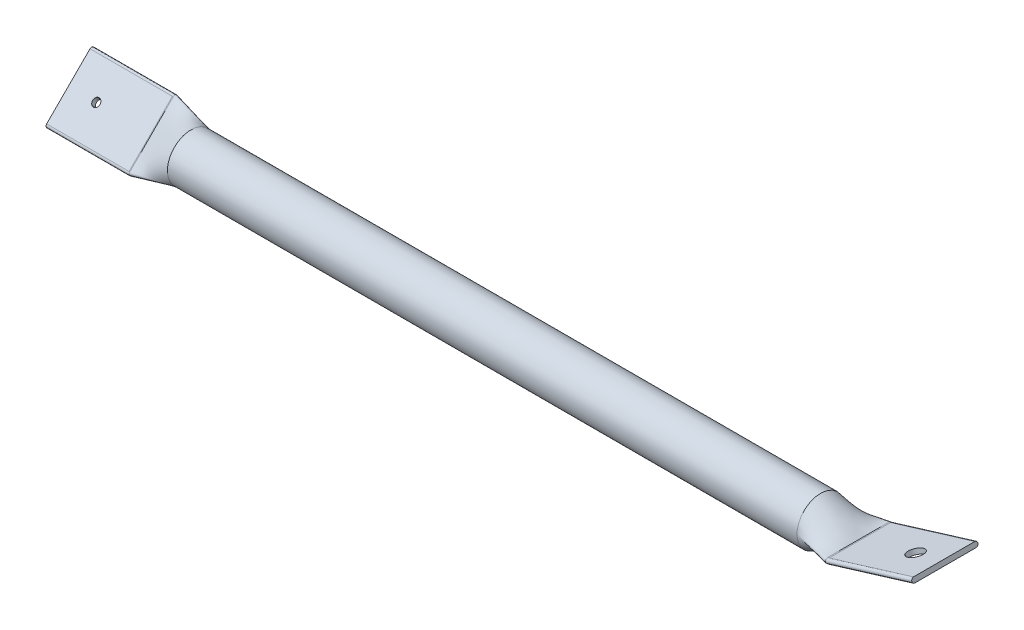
SolidWorks part; units mm, degrees
ref_plane "Front Plane" through (0, 0, 0) normal (0, 0, 1) x (1, 0, 0)
ref_plane "Top Plane" through (0, 0, 0) normal (0, 1, 0) x (1, 0, 0)
ref_plane "Right Plane" through (0, 0, 0) normal (1, 0, 0) x (0, 0, -1)
sketch "Sketch1" plane through (0, 0, 0) normal (1, 0, 0) x (0, 0, -1)
  circle A1 centre (0, 0) radius 23.9141
  dimension "D1" = 47.8282
extrude "Boss-Extrude1" add sketch "Sketch1" along normal mid plane 635
sketch "Sketch2" plane through (0, 0, 0) normal (0, 1, 0) x (1, 0, 0)
  line L0 (0, -33.3375) -> (0, 33.3375) construction
  line L1 (-355.6, 33.3375) -> (355.6, 33.3375)
  line L2 (-355.6, 33.3375) -> (-355.6, -33.3375)
  line L3 (-355.6, -33.3375) -> (355.6, -33.3375)
  line L4 (355.6, 33.3375) -> (355.6, -33.3375)
  line L5 (317.5, -23.9141) -> (317.5, 23.9141) construction
  dimension "D1" = 38.1
  dimension "D2" = 66.675
ref_plane "Plane1" through (355.6, 0, 0) normal (1, 0, 0) x (0, 0, -1)
sketch "Sketch3" plane through (355.6, 0, 0) normal (1, 0, 0) x (0, 0, -1)
  line L0 (-30.9245, 2.413) -> (30.9245, 2.413)
  line L1 (-30.9245, -2.413) -> (30.9245, -2.413)
  line L2 (0, 2.413) -> (0, -2.413) construction
  arc A0 (30.9245, 2.413) -> (30.9245, -2.413) centre (30.9245, 0) cw
  arc A1 (-30.9245, 2.413) -> (-30.9245, -2.413) centre (-30.9245, 0) ccw
  dimension "D1" = 4.826
sketch "Sketch4" plane through (317.5, 0, 0) normal (1, 0, 0) x (0, 0, -1)
  circle A1 centre (0, 0) radius 23.9141
  circle A2 centre (0, 0) radius 23.9141
  dimension "D1" = 0
loft "Loft1" add profiles "Sketch4", "Sketch3"
sketch "Sketch5" plane through (0, 0, 0) normal (0, 0, 1) x (1, 0, 0)
  line L0 (355.6, 2.413) -> (355.6, -2.413)
  line L1 (355.6, 2.413) -> (355.6, 7.239) construction
  line L2 (358.422, -1.9913) -> (355.6, 7.239) construction
  line L3 (357.011, 2.6239) -> (442.0265, 28.6157)
  line L4 (358.422, -1.9913) -> (443.4375, 24.0006)
  line L5 (443.4375, 24.0006) -> (442.0265, 28.6157)
  arc A0 (355.6, 2.413) -> (357.011, 2.6239) centre (355.6, 7.239) ccw
  arc A1 (355.6, -2.413) -> (358.422, -1.9913) centre (355.6, 7.239) ccw
  dimension "D2" = 4.826
  dimension "D1" = 17
  dimension "D3" = 88.9
extrude "Boss-Extrude2" add sketch "Sketch5" along normal up to vertex and the other way up to vertex
sketch "Sketch6" plane through (29.7841, -97.4194, 0) normal (-0.2924, 0.9563, 0) x (0.9563, 0.2924, 0)
  line L0 (400.9159, 0) -> (431.0784, 0) construction
  line L5 (431.0784, -30.9245) -> (431.0784, 30.9245) construction
  circle A0 centre (400.9159, 0) radius 7.9375
  dimension "D2" = 15.875
  dimension "D1" = 30.1625
extrude "Cut-Extrude1" cut sketch "Sketch6" against normal up to surface (4.826 mm away)
sketch "Sketch14" plane through (355.6, 0, 0) normal (1, 0, 0) x (0, 0, -1)
  line L1 (-30.9245, -2.413) -> (-30.9245, 2.413)
  line L2 (-30.9245, -2.413) -> (-30.9245, 2.413)
  arc A1 (-30.9245, 2.413) -> (-30.9245, -2.413) centre (-30.9245, 0) ccw
  arc A2 (-30.9245, 2.413) -> (-30.9245, -2.413) centre (-30.9245, 0) ccw
  dimension "D1" = 0
sketch "Sketch15" plane through (412.2424, 126.0351, 0) normal (0.9563, 0.2924, 0) x (0, 0, -1)
  line L0 (-30.9245, -106.6967) -> (-30.9245, -101.8707) construction
  line L1 (-30.9245, -106.6967) -> (-30.9245, -101.8707)
  arc A0 (-30.9245, -101.8707) -> (-30.9245, -106.6967) centre (-30.9245, -104.2837) ccw
sketch "Sketch16" plane through (0, 0, 30.9245) normal (0, 0, 1) x (1, 0, 0)
  line L0 (442.0265, 28.6157) -> (357.011, 2.6239) construction
  line L1 (442.0265, 28.6157) -> (357.011, 2.6239)
  arc A0 (355.6, 2.413) -> (357.011, 2.6239) centre (355.6, 7.239) ccw construction
  arc A1 (355.6, 2.413) -> (357.011, 2.6239) centre (355.6, 7.239) ccw
sketch "Sketch17" plane through (0, 0, 30.9245) normal (0, 0, 1) x (1, 0, 0)
  line L0 (358.422, -1.9913) -> (443.4375, 24.0006) construction
  line L1 (358.422, -1.9913) -> (443.4375, 24.0006)
  arc A0 (355.6, -2.413) -> (358.422, -1.9913) centre (355.6, 7.239) ccw construction
  arc A1 (355.6, -2.413) -> (358.422, -1.9913) centre (355.6, 7.239) ccw
loft "Loft3" add profiles "Sketch14", "Sketch15"
sketch "Sketch18" plane through (355.6, 0, 0) normal (1, 0, 0) x (0, 0, -1)
  line L1 (30.9245, 2.413) -> (30.9245, -2.413)
  line L2 (30.9245, 2.413) -> (30.9245, -2.413)
  arc A1 (30.9245, -2.413) -> (30.9245, 2.413) centre (30.9245, 0) ccw
  arc A2 (30.9245, -2.413) -> (30.9245, 2.413) centre (30.9245, 0) ccw
  dimension "D1" = 0
sketch "Sketch19" plane through (412.2424, 126.0351, 0) normal (0.9563, 0.2924, 0) x (0, 0, -1)
  line L0 (30.9245, -106.6967) -> (30.9245, -101.8707) construction
  line L1 (30.9245, -106.6967) -> (30.9245, -101.8707)
  arc A0 (30.9245, -101.8707) -> (30.9245, -106.6967) centre (30.9245, -104.2837) cw
sketch "Sketch20" plane through (0, 0, -30.9245) normal (0, 0, -1) x (-1, 0, 0)
  line L0 (-442.0265, 28.6157) -> (-357.011, 2.6239) construction
  line L1 (-442.0265, 28.6157) -> (-357.011, 2.6239)
  arc A0 (-357.011, 2.6239) -> (-355.6, 2.413) centre (-355.6, 7.239) ccw construction
  arc A1 (-357.011, 2.6239) -> (-355.6, 2.413) centre (-355.6, 7.239) ccw
sketch "Sketch21" plane through (0, 0, -30.9245) normal (0, 0, -1) x (-1, 0, 0)
  line L0 (-358.422, -1.9913) -> (-443.4375, 24.0006) construction
  line L1 (-358.422, -1.9913) -> (-443.4375, 24.0006)
  arc A0 (-358.422, -1.9913) -> (-355.6, -2.413) centre (-355.6, 7.239) ccw construction
  arc A1 (-358.422, -1.9913) -> (-355.6, -2.413) centre (-355.6, 7.239) ccw
loft "Loft4" add profiles "Sketch18", "Sketch19"
ref_plane "Plane2" through (-355.6, 0, 0) normal (-1, 0, 0) x (0, 0, 1)
sketch "Sketch7" plane through (-355.6, 0, 0) normal (-1, 0, 0) x (0, 0, 1)
  line L0 (21.8669, -21.8669) -> (-21.8669, 21.8669) construction
  line L1 (23.5732, -20.1607) -> (-20.1607, 23.5732)
  line L2 (20.1607, -23.5732) -> (-23.5732, 20.1607)
  line L3 (0, 0) -> (21.3211, 0) construction
  line L4 (-33.3375, 0) -> (33.3375, 0) construction
  arc A0 (23.5732, -20.1607) -> (20.1607, -23.5732) centre (21.8669, -21.8669) cw
  arc A1 (-20.1607, 23.5732) -> (-23.5732, 20.1607) centre (-21.8669, 21.8669) ccw
  dimension "D3" = 66.675
  dimension "D1" = 45
  dimension "D2" = 4.826
sketch "Sketch8" plane through (-317.5, 0, 0) normal (-1, 0, 0) x (0, 0, 1)
  circle A1 centre (0, 0) radius 23.9141
  circle A2 centre (0, 0) radius 23.9141
  dimension "D1" = 0
loft "Loft2" add profiles "Sketch8", "Sketch7"
sketch "Sketch11" plane through (-355.6, 0, 0) normal (-1, 0, 0) x (0, 0, 1)
  line L0 (-21.8669, 21.8669) -> (21.8669, -21.8669)
  line L1 (0, 0) -> (10.8682, 10.8682)
  line L2 (23.5732, -20.1607) -> (-20.1607, 23.5732)
  line L3 (-23.5732, 20.1607) -> (20.1607, -23.5732)
  line L4 (23.5732, -20.1607) -> (-20.1607, 23.5732)
  line L5 (-23.5732, 20.1607) -> (20.1607, -23.5732)
  arc A2 (-20.1607, 23.5732) -> (-23.5732, 20.1607) centre (-21.8669, 21.8669) ccw
  arc A3 (20.1607, -23.5732) -> (23.5732, -20.1607) centre (21.8669, -21.8669) ccw
  arc A4 (-20.1607, 23.5732) -> (-23.5732, 20.1607) centre (-21.8669, 21.8669) ccw
  arc A5 (20.1607, -23.5732) -> (23.5732, -20.1607) centre (21.8669, -21.8669) ccw
  dimension "D1" = 0
ref_plane "Plane3" through (0, 0, 0) normal (0, 0.7071, -0.7071) x (-1, 0, 0)
sketch "Sketch12" plane through (0, 0, 0) normal (0, 0.7071, -0.7071) x (-1, 0, 0)
  line L0 (355.6, 2.413) -> (355.6, -2.413)
  line L2 (355.6, -7.239) -> (356.4412, 2.3763) construction
  line L3 (356.4412, 2.3763) -> (445.0029, -5.3719)
  line L4 (356.0206, -2.4314) -> (444.5823, -10.1795)
  line L5 (444.5823, -10.1795) -> (445.0029, -5.3719)
  line L6 (355.6, -2.413) -> (355.6, -7.239) construction
  arc A0 (355.6, 2.413) -> (356.4412, 2.3763) centre (355.6, -7.239) cw
  arc A1 (355.6, -2.413) -> (356.0206, -2.4314) centre (355.6, -7.239) cw
  dimension "D3" = 4.826
  dimension "D1" = 5
  dimension "D2" = 88.9
extrude "Boss-Extrude3" add sketch "Sketch12" along normal up to vertex and the other way up to vertex
sketch "Sketch13" plane through (-2.9139, 23.5508, 23.5508) normal (-0.0872, 0.7044, 0.7044) x (0.9812, 0.183, -0.0616)
  line L0 (-407.3789, 71.5544) -> (-437.0866, 76.7724) construction
  line L1 (-431.7367, 107.2306) -> (-442.4365, 46.3142) construction
  line L2 (-407.3789, 71.5544) -> (-349.527, 61.3929) construction
  line L3 (-344.1772, 91.8511) -> (-354.8769, 30.9347) construction
  circle A0 centre (-407.3789, 71.5544) radius 3.9688
  dimension "D1" = 7.9375
  dimension "D2" = 30.1625
extrude "Cut-Extrude2" cut sketch "Sketch13" against normal up to surface (4.826 mm away)
sketch "Sketch22" plane through (-355.6, 0, 0) normal (-1, 0, 0) x (0, 0, 1)
  line L1 (-23.5732, 20.1607) -> (-20.1607, 23.5732)
  line L2 (-23.5732, 20.1607) -> (-20.1607, 23.5732)
  arc A1 (-20.1607, 23.5732) -> (-23.5732, 20.1607) centre (-21.8669, 21.8669) ccw
  arc A2 (-20.1607, 23.5732) -> (-23.5732, 20.1607) centre (-21.8669, 21.8669) ccw
  dimension "D1" = 0
sketch "Sketch23" plane through (-442.089, -27.3493, -27.3493) normal (-0.9962, -0.0616, -0.0616) x (-0.0615, -0.0038, 0.9981)
  line L0 (-1.7189, 42.092) -> (1.6871, 45.511) construction
  line L1 (-1.7189, 42.092) -> (1.6871, 45.511)
  arc A0 (1.6871, 45.511) -> (-1.7189, 42.092) centre (-0.0159, 43.8015) ccw
sketch "Sketch24" plane through (0, 21.8669, -21.8669) normal (0, 0.7071, -0.7071) x (1, 0, 0)
  line L0 (-445.0029, 5.3719) -> (-356.4412, -2.3763) construction
  line L1 (-445.0029, 5.3719) -> (-356.4412, -2.3763)
  arc A0 (-356.4412, -2.3763) -> (-355.6, -2.413) centre (-355.6, 7.239) ccw construction
  arc A1 (-356.4412, -2.3763) -> (-355.6, -2.413) centre (-355.6, 7.239) ccw
sketch "Sketch25" plane through (0, 21.8669, -21.8669) normal (0, 0.7071, -0.7071) x (1, 0, 0)
  line L0 (-356.0206, 2.4314) -> (-444.5823, 10.1795) construction
  line L1 (-356.0206, 2.4314) -> (-444.5823, 10.1795)
  arc A0 (-356.0206, 2.4314) -> (-355.6, 2.413) centre (-355.6, 7.239) ccw construction
  arc A1 (-356.0206, 2.4314) -> (-355.6, 2.413) centre (-355.6, 7.239) ccw
loft "Loft5" add profiles "Sketch22", "Sketch23"
sketch "Sketch26" plane through (-355.6, 0, 0) normal (-1, 0, 0) x (0, 0, 1)
  line L1 (23.5732, -20.1607) -> (20.1607, -23.5732)
  line L2 (23.5732, -20.1607) -> (20.1607, -23.5732)
  arc A1 (20.1607, -23.5732) -> (23.5732, -20.1607) centre (21.8669, -21.8669) ccw
  arc A2 (20.1607, -23.5732) -> (23.5732, -20.1607) centre (21.8669, -21.8669) ccw
  dimension "D1" = 0
sketch "Sketch27" plane through (-442.089, -27.3493, -27.3493) normal (-0.9962, -0.0616, -0.0616) x (-0.0615, -0.0038, 0.9981)
  line L0 (42.0983, -1.5584) -> (45.5043, 1.8606) construction
  line L1 (42.0983, -1.5584) -> (45.5043, 1.8606)
  arc A0 (42.0983, -1.5584) -> (45.5043, 1.8606) centre (43.8013, 0.1511) ccw
sketch "Sketch28" plane through (0, -21.8669, 21.8669) normal (0, -0.7071, 0.7071) x (1, 0, 0)
  line L0 (-356.0206, -2.4314) -> (-444.5823, -10.1795) construction
  line L1 (-356.0206, -2.4314) -> (-444.5823, -10.1795)
  arc A0 (-355.6, -2.413) -> (-356.0206, -2.4314) centre (-355.6, -7.239) ccw construction
  arc A1 (-355.6, -2.413) -> (-356.0206, -2.4314) centre (-355.6, -7.239) ccw
sketch "Sketch29" plane through (0, -21.8669, 21.8669) normal (0, -0.7071, 0.7071) x (1, 0, 0)
  line L0 (-445.0029, -5.3719) -> (-356.4412, 2.3763) construction
  line L1 (-445.0029, -5.3719) -> (-356.4412, 2.3763)
  arc A0 (-355.6, 2.413) -> (-356.4412, 2.3763) centre (-355.6, -7.239) ccw construction
  arc A1 (-355.6, 2.413) -> (-356.4412, 2.3763) centre (-355.6, -7.239) ccw
loft "Loft6" add profiles "Sketch26", "Sketch27"
